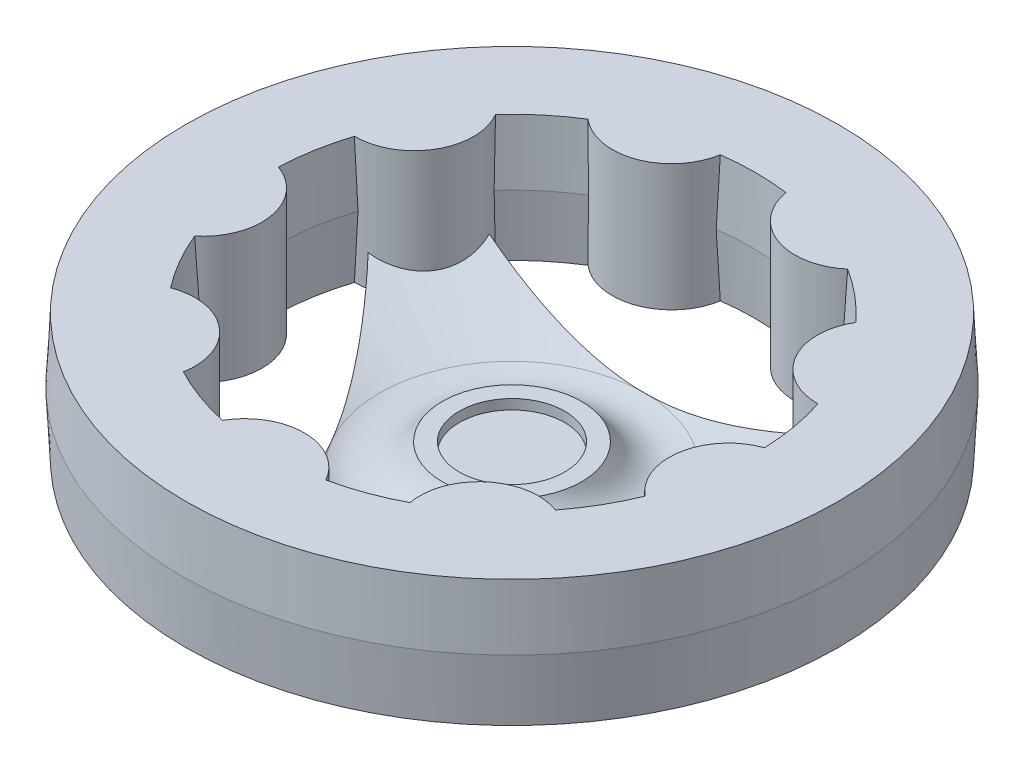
SolidWorks part; units mm, degrees
ref_plane "Front Plane" through (0, 0, 0) normal (0, 0, 1) x (1, 0, 0)
ref_plane "Top Plane" through (0, 0, 0) normal (0, 1, 0) x (1, 0, 0)
ref_plane "Right Plane" through (0, 0, 0) normal (1, 0, 0) x (0, 0, -1)
sketch "Sketch1" plane through (0, 0, 0) normal (0, 0, 1) x (1, 0, 0)
  line L0 (0, 0) -> (0, 45.9521) construction
  line L1 (0, 0) -> (12, 0)
  line L2 (12, 0) -> (12, -13.6)
  line L3 (12, -13.6) -> (13.2, -14.8)
  line L4 (13.2, -14.8) -> (13.2, -16)
  line L5 (13.2, -16) -> (12, -16)
  line L6 (12, -16) -> (12, -27.4)
  line L7 (11.4, -28) -> (3.6, -28)
  line L8 (0, -7) -> (0, 0)
  line L9 (0, -7) -> (3, -8.7321)
  line L10 (3, -8.7321) -> (3, -27.4)
  line L11 (3, -27.4) -> (3.6, -28)
  line L12 (12, -27.4) -> (11.4, -28)
  point P9 (12, -28)
  point P13 (3, -28)
revolve "Revolve1" add sketch "Sketch1" angle 360 about L0
sketch "Sketch2" plane through (0, 0, 0) normal (0, 0, 1) x (1, 0, 0)
  line L0 (12, 0) -> (-12, 0) construction
  line L1 (12, -13.6) -> (12, 0) construction
  line L2 (13.2, -14.8) -> (12, -13.6) construction
  line L3 (13.2, -16) -> (13.2, -14.8) construction
  line L4 (12, 0) -> (10, 0)
  line L5 (12, -13.6) -> (12, 0)
  line L6 (13.2, -14.8) -> (12, -13.6)
  line L7 (13.2, -16) -> (13.2, -14.8)
  line L8 (10, 0) -> (10, 1.875)
  line L9 (10, 1.875) -> (13.2, 1.875)
  line L10 (13.2, -16) -> (14.4, -16)
  line L11 (14.4, -16) -> (14.4, -14.1657)
  line L12 (17.3185, -9.8389) -> (42.2598, 0.2381)
  line L13 (49.1, -1) -> (49.1, 19.4)
  line L14 (49.1, 19.4) -> (58.9, 19.4)
  line L15 (58.9, 19.4) -> (58.9, -1)
  line L16 (58.9, -1) -> (61.8711, -1)
  line L17 (62.5, -1) -> (62.5, 23) construction
  line L18 (61.8711, 23) -> (46.1289, 23)
  line L19 (45.5, 23) -> (45.5, -1) construction
  line L20 (45.5, -1) -> (49.1, -1)
  line L21 (0, 0) -> (0, -29.5318) construction
  line L22 (-11.4, -28) -> (11.4, -28) construction
  line L23 (25.0725, -2.6615) -> (45.5, 5.5917)
  line L24 (62.5, 11) -> (61.8711, 23)
  line L25 (62.5, 11) -> (61.8711, -1)
  line L26 (62.5, 11) -> (45.5, 11) construction
  line L27 (45.5, 11) -> (46.1289, 23)
  line L28 (45.5, 11) -> (45.5, 5.5917)
  line L29 (13.2, 1.875) -> (13.2, -7.4583) construction
  line L30 (13.2, -7.4583) -> (25.0725, -2.6615) construction
  line L31 (42.2598, 0.2381) -> (45.5, 1.5472) construction
  arc A0 (45.5, -1) -> (42.2598, 0.2381) centre (43.214, -2.1236) ccw
  arc A1 (13.2, 1.875) -> (25.0725, -2.6615) centre (21.5762, 5.9922) ccw
  arc A2 (17.3185, -9.8389) -> (14.4, -14.1657) centre (19.0667, -14.1657) ccw
  point P30 (14.4, -11.018)
revolve "Revolve2" add sketch "Sketch2" angle 360 about L21
sketch "Sketch3" plane through (0, 23, 0) normal (0, 1, 0) x (1, 0, 0)
  line L0 (0, 0) -> (0, 72.8617) construction
  line L1 (0, 0) -> (68.2353, 39.3957) construction
  line L2 (0, 0) -> (-63.5801, 36.708) construction
  line L3 (0, 0) -> (34.855, 29.2468) construction
  line L4 (0, 0) -> (-34.855, 29.2468) construction
  arc A2 (34.855, 29.2468) -> (-34.855, 29.2468) centre (0, 0) ccw
  arc A3 (-34.855, 29.2468) -> (34.855, 29.2468) centre (0, 172.6759) ccw
  circle A4 centre (0, 0) radius 25.0725 construction
  circle A5 centre (0, 0) radius 45.5 construction
  dimension "D1" = 120
  dimension "D2" = 10
extrude "Extrude1" cut sketch "Sketch3" against normal through all
pattern_circular "CirPattern1" count 3 over 360 about axis through (0, 0, 0) along (0, 1, 0) of "Extrude1"
ref_plane "Plane2" through (0, 11, 0) normal (0, 1, 0) x (-1, 0, 0)
draft "Draft5" type of draft neutral plane draft angle 3 neutral plane "Plane2" faces to draft 1 parameters "D1"=3
sketch "Sketch5" plane through (0, 23, 0) normal (0, 1, 0) x (1, 0, 0)
  line L0 (0, -46.1289) -> (0, -61.8711) construction
  circle A0 centre (0, 0) radius 46.1289 construction
  circle A1 centre (0, 0) radius 61.8711 construction
  arc A2 (9.7897, -45.0781) -> (-9.7897, -45.0781) centre (0, -50.6211) ccw
  arc A3 (-9.7897, -45.0781) -> (9.7897, -45.0781) centre (0, 0) ccw
  arc A4 (-9.7897, -45.0781) -> (9.7897, -45.0781) centre (0, -50.6211) ccw construction
  dimension "D1" = 11.25
extrude "Extrude2" add sketch "Sketch5" against normal up to surface (24 mm away)
pattern_circular "CirPattern2" count 9 over 360 about axis through (0, 0, 0) along (0, 1, 0) of "Extrude2"
sketch "Sketch6" plane through (0, 19.4, 0) normal (0, -1, 0) x (1, 0, 0)
  circle A1 centre (0, 50.6211) radius 11.25
  arc A2 (-9.7897, 45.0781) -> (9.7897, 45.0781) centre (0, 50.6211) ccw construction
extrude "Extrude3" add sketch "Sketch6" along normal up to surface (20.4 mm away)
sketch "Sketch9" plane through (0, 0, 0) normal (1, 0, 0) x (0, 0, -1)
  line L0 (-50.6211, 5.64) -> (-50.6211, -17.9981) construction
  line L1 (-50.6211, -1) -> (-50.6211, 23) construction
  line L2 (-44.6211, -1) -> (-44.6211, 2)
  line L3 (-45.0781, -1) -> (-39.3711, -1) construction
  line L4 (-44.6211, 2) -> (-47.6211, 5)
  line L5 (-47.6211, 5) -> (-47.6211, 9)
  line L6 (-47.6211, 9) -> (-50.6211, 9)
  line L7 (-50.6211, 9) -> (-50.6211, -1)
  line L8 (-58.3269, -1) -> (-47.8728, -1) construction
  line L9 (-50.6211, -1) -> (-44.6211, -1)
  dimension "D1" = 45
  dimension "D2" = 12
  dimension "D3" = 3
  dimension "D4" = 3
  dimension "D5" = 4
revolve "Cut-Revolve1" cut sketch "Sketch9" angle 360 about L0
equation "\"D3@Sketch1\" = \"D2@Sketch1\"*.05"
equation "\"D8@Sketch1\" = \"D5@Sketch1\"*0.75"
equation "\"D9@Sketch1\" = \"D6@Sketch1\"*0.1"
equation "\"D12@Sketch1\" = \"D9@Sketch1\""
equation "\"D10@Sketch1\" = \"D9@Sketch1\""
equation "\"D11@Sketch1\" = \"D9@Sketch1\""
equation "\"D4@Sketch2\" = \"D3@Sketch2\"*0.15"
equation "\"D5@Sketch2\" = \"D4@Sketch2\""
equation "\"D8@Sketch2\" = \"D5@Sketch2\""
equation "\"D12@Sketch2\" = \"D6@Sketch2\"*0.06"
equation "\"D1@Sketch2\" = \"D3@Sketch1\""
equation "\"D15@Sketch2\" = \"D9@Sketch2\""
equation "\"D17@Sketch2\" = \"D9@Sketch2\"*0.5"
equation "\"D11@Sketch2\" = \"D22@Sketch2\""
